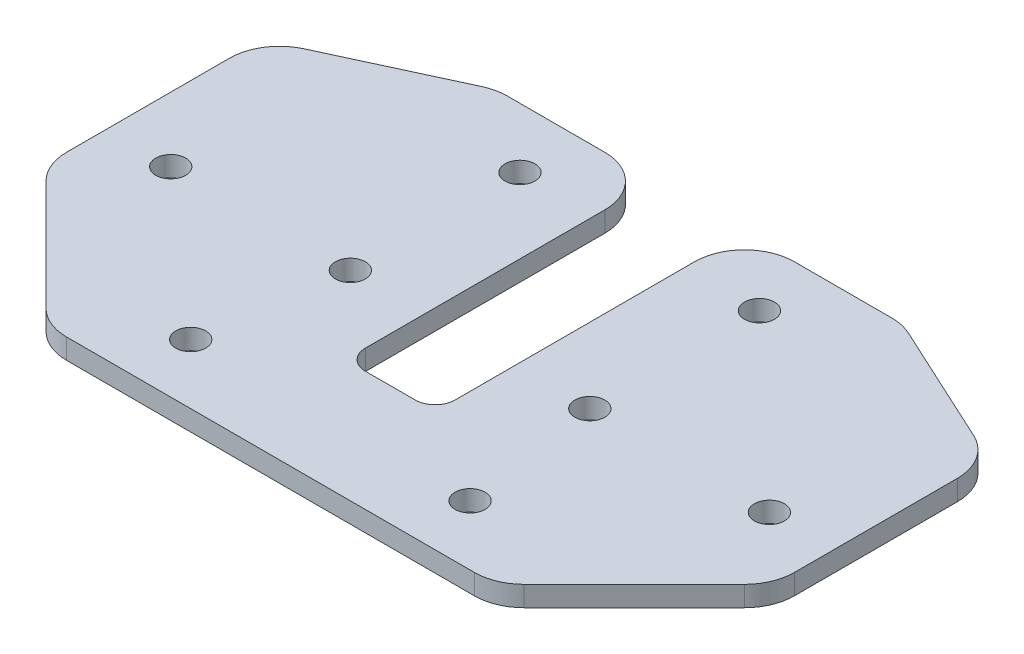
SolidWorks part; units mm, degrees
ref_plane "Front Plane" through (0, 0, 0) normal (0, 0, 1) x (1, 0, 0)
ref_plane "Top Plane" through (0, 0, 0) normal (0, 1, 0) x (1, 0, 0)
ref_plane "Right Plane" through (0, 0, 0) normal (1, 0, 0) x (0, 0, -1)
sketch "Sketch1" plane through (0, 0, 0) normal (0, 1, 0) x (1, 0, 0)
  line L0 (-7.231, 25.1405) -> (-7.231, 17.5205) construction
  line L1 (32.139, -17.8595) -> (14.139, -17.8595)
  line L2 (32.139, -5.8595) -> (32.139, 25.1405)
  line L3 (32.139, 25.1405) -> (16.264, 25.1405)
  line L4 (0.169, 10.0805) -> (0.169, 17.7005)
  line L5 (32.139, -17.8595) -> (21.1431, -11.7491) construction
  line L6 (32.139, 25.1405) -> (23.3958, 18.3012) construction
  line L7 (0.169, 10.0805) -> (0.169, -3.8895)
  line L8 (32.139, -17.8595) -> (36.639, -17.8595)
  line L9 (0.169, 17.7005) -> (5.8735, 17.7005) construction
  line L10 (16.264, 25.1405) -> (0.169, 17.7005)
  line L11 (14.139, -17.8595) -> (0.169, -3.8895)
  line L12 (16.0335, 17.7005) -> (16.044, 17.7005) construction
  line L13 (36.639, -17.8595) -> (36.639, -5.8595)
  line L14 (36.639, -5.8595) -> (32.139, -5.8595)
  circle A0 centre (24.639, 19.1405) radius 1.5
  circle A1 centre (24.639, 2.1405) radius 1.5
  circle A2 centre (22.639, -11.8595) radius 1.5
  circle A3 centre (6.639, 2.1405) radius 1.5
  point P0 (0, 0)
  dimension "D13" = 3
  dimension "D14" = 3
  dimension "D15" = 3
  dimension "D10" = 30
  dimension "D2" = 2
  dimension "D3" = 6
  dimension "D4" = 17
  dimension "D5" = 14
  dimension "D6" = 7.5
  dimension "D7" = 7.5
  dimension "D8" = 12
  dimension "D9" = 6
  dimension "D11" = 18
  dimension "D12" = 43
extrude "Boss-Extrude1" add sketch "Sketch1" along normal blind 2.032
mirror "Mirror1" about plane through (36.639, 2.032, 17.8595) normal (-1, 0, 0) of "Boss-Extrude1"
fillet "Fillet1" radius 5 10 edges at (41.139, 1.016, -25.1405) (57.014, 1.016, -25.1405) (73.109, 1.016, -17.7005) (73.109, 1.016, 3.8895) (59.139, 1.016, 17.8595) (14.139, 1.016, 17.8595) (0.169, 1.016, 3.8895) (0.169, 1.016, -17.7005) (16.264, 1.016, -25.1405) (32.139, 1.016, -25.1405)
fillet "Fillet2" radius 2 2 edges at (32.139, 1.016, 5.8595) (41.139, 1.016, 5.8595)
